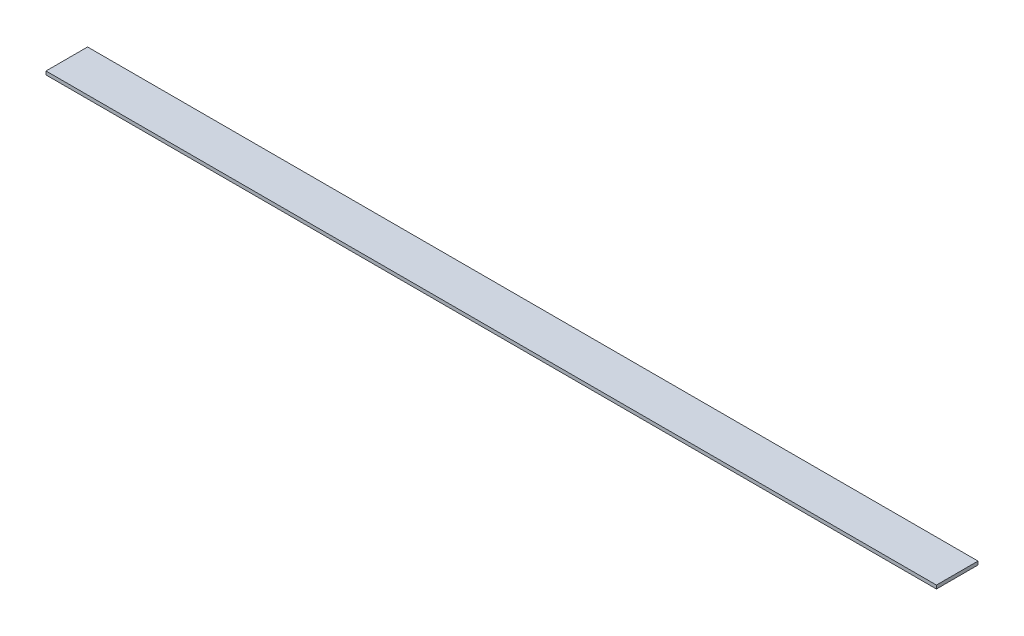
SolidWorks part; units mm, degrees
ref_plane "FRONT" through (0, 0, 0) normal (0, 0, 1) x (1, 0, 0)
ref_plane "TOP" through (0, 0, 0) normal (0, 1, 0) x (1, 0, 0)
ref_plane "RIGHT" through (0, 0, 0) normal (1, 0, 0) x (0, 0, -1)
sketch "Sketch1" plane through (0, 0, 0) normal (0, 1, 0) x (1, 0, 0)
  line L1 (-815.975, 38.1) -> (815.975, 38.1)
  line L2 (-815.975, 38.1) -> (-815.975, -38.1)
  line L3 (-815.975, -38.1) -> (815.975, -38.1)
  line L4 (815.975, 38.1) -> (815.975, -38.1)
  line L5 (-815.975, 38.1) -> (815.975, -38.1) construction
  line L6 (-815.975, -38.1) -> (815.975, 38.1) construction
  point P0 (0, 0)
  dimension "D1" = 76.2
  dimension "D2" = 1631.95
extrude "Boss-Extrude1" add sketch "Sketch1" along normal blind 6.35
